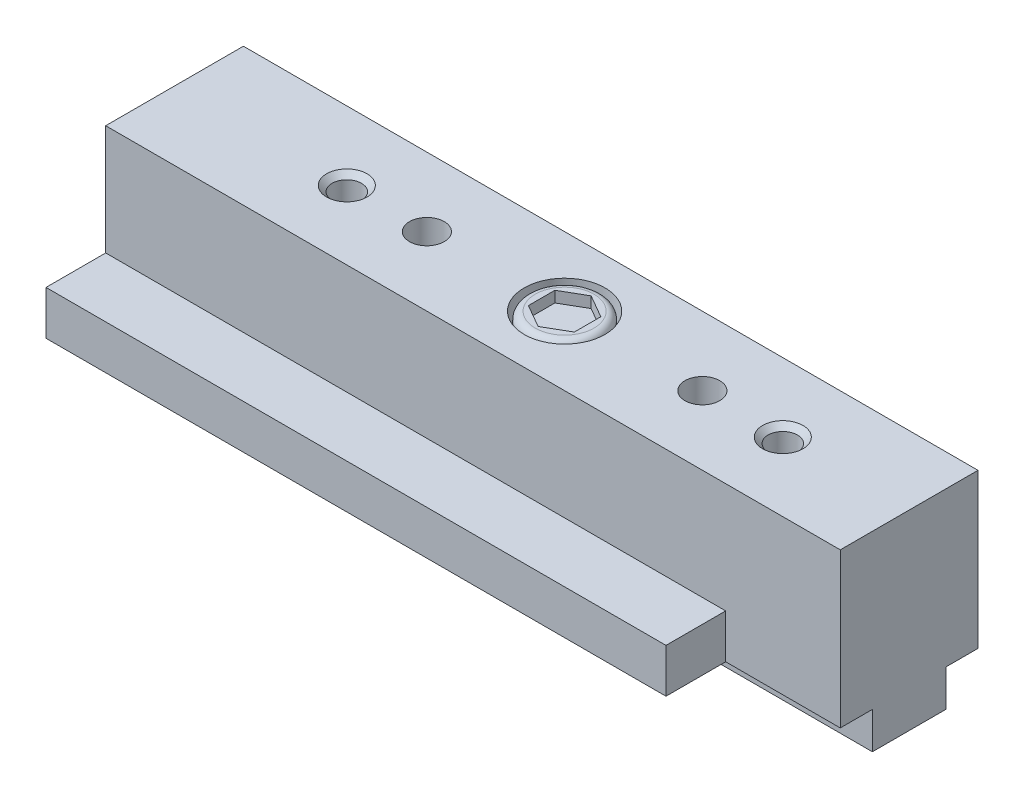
SolidWorks part; units mm, degrees
ref_plane "Front Plane" through (0, 0, 0) normal (0, 0, 1) x (1, 0, 0)
ref_plane "Top Plane" through (0, 0, 0) normal (0, 1, 0) x (1, 0, 0)
ref_plane "Right Plane" through (0, 0, 0) normal (1, 0, 0) x (0, 0, -1)
sketch "Sketch1" plane through (0, 0, 0) normal (1, 0, 0) x (0, 0, -1)
  line L0 (-8.89, 2.54) -> (-2.54, 2.54)
  line L1 (-2.54, 2.54) -> (-2.54, 0)
  line L2 (-2.54, 0) -> (2.54, 0)
  line L3 (2.54, 0) -> (2.54, 2.54)
  line L4 (2.54, 2.54) -> (8.89, 2.54)
  line L5 (8.89, 2.54) -> (8.89, 5.588)
  line L6 (8.89, 5.588) -> (4.7625, 5.588)
  line L7 (4.7625, 5.588) -> (4.7625, 13.208)
  line L8 (4.7625, 13.208) -> (-4.7625, 13.208)
  line L9 (-4.7625, 13.208) -> (-4.7625, 5.588)
  line L10 (-4.7625, 5.588) -> (-8.89, 5.588)
  line L11 (-8.89, 5.588) -> (-8.89, 2.54)
extrude "Extrude1" add sketch "Sketch1" along normal blind 42.8752
ref_plane "Plane1" through (42.8752, 0, 0) normal (1, 0, 0) x (0, 0, -1)
sketch "Sketch2" plane through (42.8752, 0, 0) normal (1, 0, 0) x (0, 0, -1)
  line L0 (-4.7625, 2.54) -> (-2.54, 2.54)
  line L1 (-2.54, 2.54) -> (-2.54, 0)
  line L2 (-2.54, 0) -> (2.54, 0)
  line L3 (2.54, 0) -> (2.54, 2.54)
  line L4 (2.54, 2.54) -> (4.7625, 2.54)
  line L5 (4.7625, 2.54) -> (4.7625, 13.208)
  line L6 (4.7625, 13.208) -> (-4.7625, 13.208)
  line L7 (-4.7625, 13.208) -> (-4.7625, 2.54)
extrude "Extrude2" add sketch "Sketch2" along normal blind 7.9248
ref_plane "Plane2" through (42.0624, 0, 0) normal (1, 0, 0) x (0, 0, -1)
sketch "Sketch3" plane through (42.0624, 0, 0) normal (1, 0, 0) x (0, 0, -1)
  line L0 (0, 13.208) -> (1.397, 13.208)
  line L1 (1.397, 13.208) -> (1.016, 12.827)
  line L2 (1.016, 12.827) -> (1.016, 5.5396)
  line L3 (1.016, 5.5396) -> (0, 4.953)
  line L4 (0, 4.953) -> (0, 13.208)
  line L5 (0, 4.953) -> (0, 13.208) construction
revolve "Cut-Revolve1" cut sketch "Sketch3" angle 360 about L5
ref_plane "Plane3" through (11.9126, 0, 0) normal (1, 0, 0) x (0, 0, -1)
sketch "Sketch4" plane through (11.9126, 0, 0) normal (1, 0, 0) x (0, 0, -1)
  line L0 (0, 13.208) -> (1.397, 13.208)
  line L1 (1.397, 13.208) -> (1.016, 12.827)
  line L2 (1.016, 12.827) -> (1.016, 5.5396)
  line L3 (1.016, 5.5396) -> (0, 4.953)
  line L4 (0, 4.953) -> (0, 13.208)
  line L5 (0, 4.953) -> (0, 13.208) construction
revolve "Cut-Revolve2" cut sketch "Sketch4" angle 360 about L5
ref_plane "Plane4" through (0, 13.208, 0) normal (0, 1, 0) x (-1, 0, 0)
sketch "Sketch5" plane through (0, 13.208, 0) normal (0, 1, 0) x (-1, 0, 0)
  circle A0 centre (-36.4998, 0) radius 1.2027
extrude "Cut-Extrude1" cut sketch "Sketch5" against normal blind 3.048
sketch "Sketch6" plane through (0, 13.208, 0) normal (0, 1, 0) x (-1, 0, 0)
  circle A0 centre (-17.4498, 0) radius 1.2027
extrude "Cut-Extrude2" cut sketch "Sketch6" against normal blind 3.048
sketch "Sketch7" plane through (0, 13.208, 0) normal (0, 1, 0) x (-1, 0, 0)
  circle A0 centre (-26.9748, 0) radius 2.794
extrude "Cut-Extrude3" cut sketch "Sketch7" against normal blind 1.524
ref_plane "Plane5" through (26.9748, 0, 0) normal (1, 0, 0) x (0, 0, -1)
sketch "Sketch8" plane through (26.9748, 0, 0) normal (1, 0, 0) x (0, 0, -1)
  line L0 (0, 13.208) -> (2.032, 13.208)
  line L1 (2.54, 12.7) -> (2.54, 11.684)
  line L2 (2.54, 11.684) -> (0, 11.684)
  line L3 (0, 11.684) -> (0, 13.208)
  line L4 (0, 11.684) -> (0, 13.208) construction
  arc A0 (2.032, 13.208) -> (2.54, 12.7) centre (2.032, 12.7) cw
revolve "Revolve1" add sketch "Sketch8" angle 360 about L4
sketch "Sketch9" plane through (0, 13.208, 0) normal (0, 1, 0) x (-1, 0, 0)
  line L0 (-25.3873, -0.9165) -> (-25.3873, 0.9165)
  line L1 (-25.3873, 0.9165) -> (-26.9748, 1.8331)
  line L2 (-26.9748, 1.8331) -> (-28.5623, 0.9165)
  line L3 (-28.5623, 0.9165) -> (-28.5623, -0.9165)
  line L4 (-28.5623, -0.9165) -> (-26.9748, -1.8331)
  line L5 (-26.9748, -1.8331) -> (-25.3873, -0.9165)
extrude "Cut-Extrude4" cut sketch "Sketch9" against normal blind 0.762
ref_plane "Plane6" through (50.8, 0, 0) normal (1, 0, 0) x (0, 0, -1)
ref_plane "Plane7" through (36.4998, 0, 0) normal (1, 0, 0) x (0, 0, -1)
